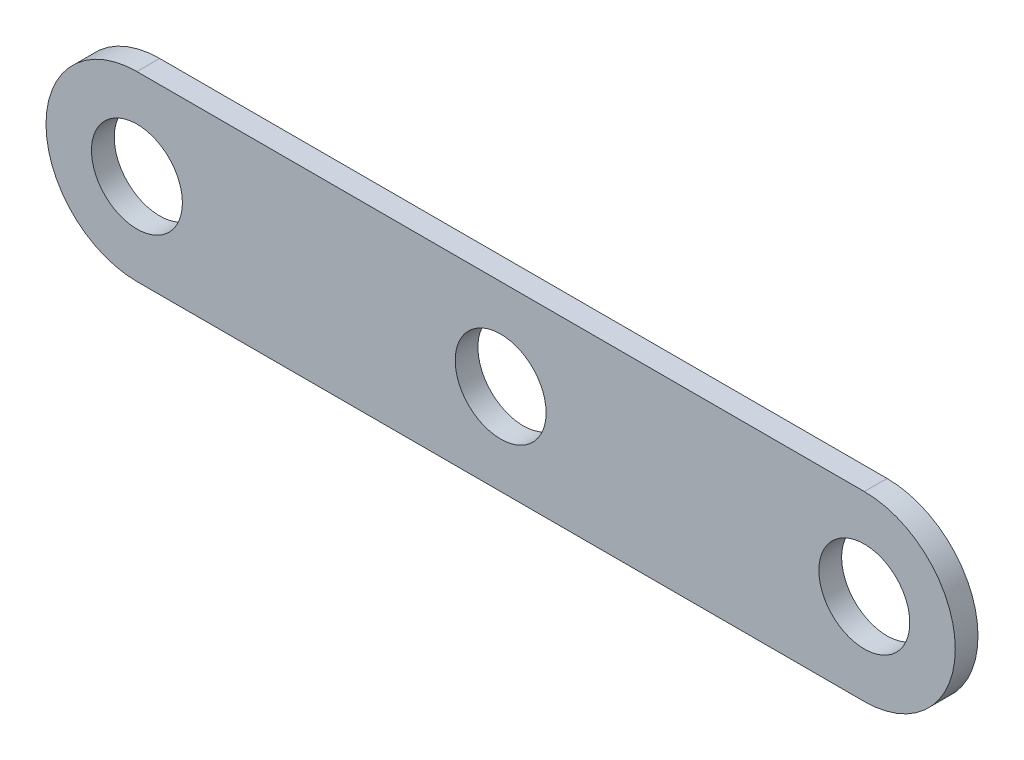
SolidWorks part; units mm, degrees
ref_plane "Front Plane" through (0, 0, 0) normal (0, 0, 1) x (1, 0, 0)
ref_plane "Top Plane" through (0, 0, 0) normal (0, 1, 0) x (1, 0, 0)
ref_plane "Right Plane" through (0, 0, 0) normal (1, 0, 0) x (0, 0, -1)
sketch "Sketch1" plane through (0, 0, 0) normal (0, 0, 1) x (1, 0, 0)
  line L0 (-400, 0) -> (400, 0) construction
  line L1 (-400, 100) -> (400, 100)
  line L2 (-400, -100) -> (400, -100)
  line L3 (0, 0) -> (0, 147.2156) construction
  arc A0 (-400, 100) -> (-400, -100) centre (-400, 0) ccw
  arc A1 (400, -100) -> (400, 100) centre (400, 0) ccw
  circle A2 centre (-400, 0) radius 50
  circle A16 centre (400, 0) radius 50
  circle A17 centre (0, 0) radius 50
  point P2 (0, 0)
  dimension "D2" = 100
  dimension "D3" = 100
  dimension "D4" = 100
  dimension "D1" = 800
extrude "Boss-Extrude1" add sketch "Sketch1" along normal blind 25
